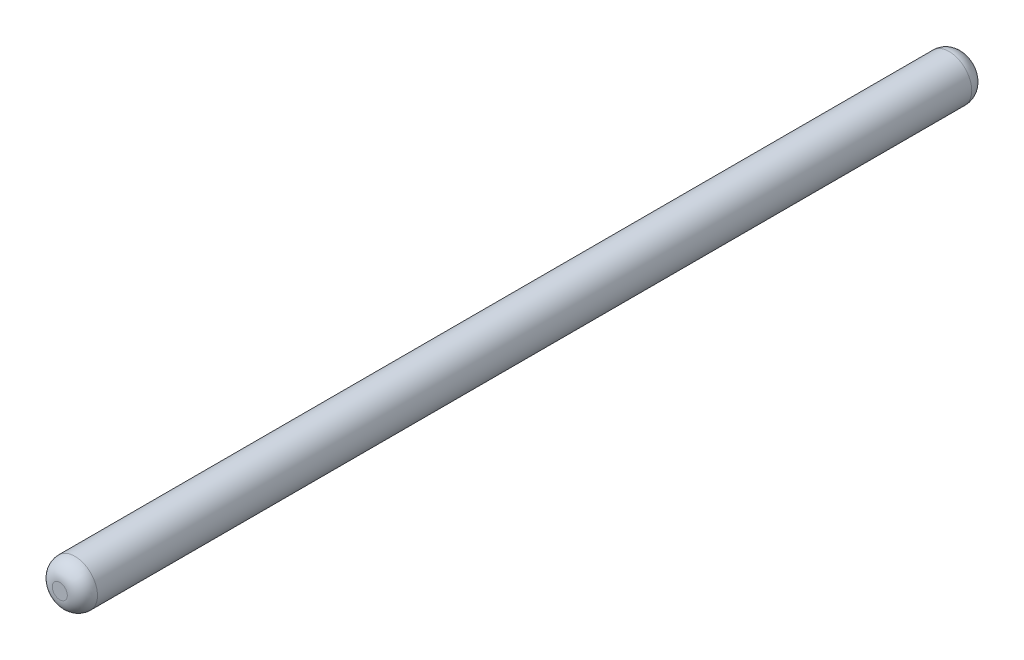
SolidWorks part; units mm, degrees
ref_plane "Alzado" through (0, 0, 0) normal (0, 0, 1) x (1, 0, 0)
ref_plane "Planta" through (0, 0, 0) normal (0, 1, 0) x (1, 0, 0)
ref_plane "Vista lateral" through (0, 0, 0) normal (1, 0, 0) x (0, 0, -1)
sketch "Croquis1" plane through (0, 0, 0) normal (0, 0, 1) x (1, 0, 0)
  circle A0 centre (0, 0) radius 1.5
  dimension "D1" = 3
extrude "Saliente-Extruir1" add sketch "Croquis1" along normal mid plane 60
fillet "Redondeo1" radius 1 2 edges at (1.5, 0, -30) (1.5, 0, 30)
